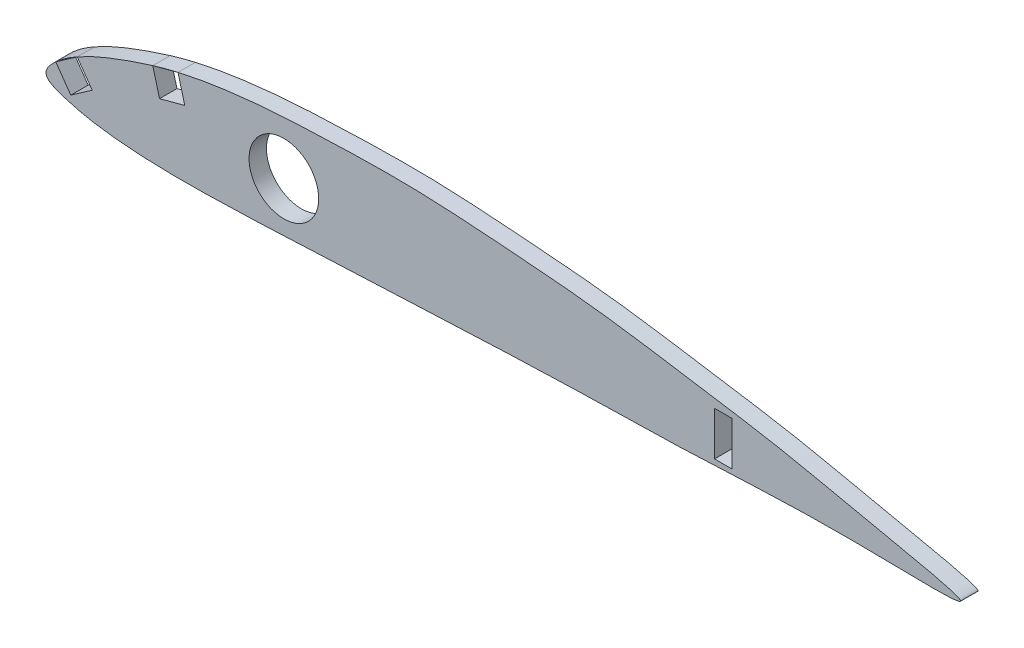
SolidWorks part; units mm, degrees
ref_plane "Front Plane" through (0, 0, 0) normal (0, 0, 1) x (1, 0, 0)
ref_plane "Top Plane" through (0, 0, 0) normal (0, 1, 0) x (1, 0, 0)
ref_plane "Right Plane" through (0, 0, 0) normal (1, 0, 0) x (0, 0, -1)
sketch3d "3DSketch1"
  spline S1 degree 3 poles (4.3194, -2.565, 0) (-1.596, -0.7014, 0) (1.9019, 2.8945, 0) (4.6685, 4.8759, 0) (8.2541, 6.8067, 0) (15.1207, 9.5999, 0) (23.4504, 12.2575, 0) (33.3103, 13.8343, 0) (41.6672, 14.6683, 0) (52.791, 15.1345, 0) (66.7098, 15.5292, 0) (83.3686, 14.3601, 0) (100.1477, 13.0526, 0) (116.546, 10.4257, 0) (134.137, 7.7365, 0) (147.5618, 4.5783, 0) (176.1388, -1.0823, 0) (139.163, 0.22, 0) (123.0831, -1.2515, 0) (88.371, -1.7987, 0) (61.2366, -3.2772, 0) (33.2994, -4.495, 0) (19.5697, -4.7201, 0) (9.464, -3.7414, 0) (4.3194, -2.565, 0) (-1.596, -0.7014, 0) (1.9019, 2.8945, 0) knots -0.051806 -0.027094 -0.014492 0 0.01056 0.018211 0.03221 0.045525 0.084069 0.108974 0.133649 0.158233 0.207343 0.256523 0.305826 0.355445 0.405214 0.45539 0.506007 0.555122 0.65337 0.70249 0.849939 0.899083 0.948194 0.972906 0.985508 1 1.01056 1.018211 1.03221 only from (0, 0, 0) to (0, 0, 0)
  dimension "D1" = 166.73
extrude "Boss-Extrude1" add sketch "3DSketch1" along direction (0, 0, 1) on the side of the normal blind 3.175
sketch "Sketch1" plane through (0, 0, 3.175) normal (0, 0, 1) x (1, 0, 0)
  line L0 (0, 0) -> (166.73, 0) construction
  line L1 (83.365, 0) -> (83.365, 5) construction
  line L2 (83.365, 5) -> (43.365, 5) construction
  line L3 (5.6876, 5.3863) -> (1.7864, 2.6546)
  line L4 (125.047, 0) -> (121.872, 0)
  line L5 (5.6876, 5.3863) -> (8.4193, 1.4851)
  line L6 (125.047, 0) -> (125.047, 8)
  line L7 (125.047, 8) -> (121.872, 8)
  line L8 (121.872, 0) -> (121.872, 8)
  line L9 (1.7864, 2.6546) -> (4.5181, -1.2466)
  line L10 (8.4193, 1.4851) -> (4.5181, -1.2466)
  line L11 (19.4658, 10.89) -> (24.066, 12.1227)
  line L12 (19.4658, 10.89) -> (20.6984, 6.2898)
  line L13 (24.066, 12.1227) -> (25.2986, 7.5224)
  line L14 (20.6984, 6.2898) -> (25.2986, 7.5224)
  circle A0 centre (43.365, 5) radius 6.35
  spline S0 degree 3 poles (1.9019, 2.8945) (-1.596, -0.7014) (4.3194, -2.565) (9.464, -3.7414) (19.5697, -4.7201) (33.2994, -4.495) (61.2366, -3.2772) (88.371, -1.7987) (123.0831, -1.2515) (139.163, 0.22) (176.1388, -1.0823) (147.5618, 4.5783) (134.137, 7.7365) (116.546, 10.4257) (100.1477, 13.0526) (83.3686, 14.3601) (66.7098, 15.5292) (52.791, 15.1345) (41.6672, 14.6683) (33.3103, 13.8343) (23.4504, 12.2575) (15.1207, 9.5999) (8.2541, 6.8067) (4.6685, 4.8759) (1.9019, 2.8945) (-1.596, -0.7014) (4.3194, -2.565) knots -0.03221 -0.018211 -0.01056 0 0.014492 0.027094 0.051806 0.100917 0.150061 0.29751 0.34663 0.444878 0.493993 0.54461 0.594786 0.644555 0.694174 0.743477 0.792657 0.841767 0.866351 0.891026 0.915931 0.954475 0.96779 0.981789 0.98944 1 1.014492 1.027094 1.051806 only from (0, 0) to (0, 0) construction
  spline S1 degree 3 poles (1.9019, 2.8945) (-1.596, -0.7014) (4.3194, -2.565) (9.464, -3.7414) (19.5697, -4.7201) (33.2994, -4.495) (61.2366, -3.2772) (88.371, -1.7987) (123.0831, -1.2515) (139.163, 0.22) (176.1388, -1.0823) (147.5618, 4.5783) (134.137, 7.7365) (116.546, 10.4257) (100.1477, 13.0526) (83.3686, 14.3601) (66.7098, 15.5292) (52.791, 15.1345) (41.6672, 14.6683) (33.3103, 13.8343) (23.4504, 12.2575) (15.1207, 9.5999) (8.2541, 6.8067) (4.6685, 4.8759) (1.9019, 2.8945) (-1.596, -0.7014) (4.3194, -2.565) knots -0.03221 -0.018211 -0.01056 0 0.014492 0.027094 0.051806 0.100917 0.150061 0.29751 0.34663 0.444878 0.493993 0.54461 0.594786 0.644555 0.694174 0.743477 0.792657 0.841767 0.866351 0.891026 0.915931 0.954475 0.96779 0.981789 0.98944 1 1.014492 1.027094 1.051806 only from (0, 0) to (0, 0) construction
  dimension "D3" = 41.682
  dimension "D1" = 5
  dimension "D2" = 40
  dimension "D4" = 8
  dimension "D5" = 3.175
  dimension "D6" = 4.7625
  dimension "D7" = 4.7625
  dimension "D8" = 55
  dimension "D9" = 4.7625
  dimension "D10" = 4.7625
  dimension "D11" = 75
extrude "Cut-Extrude2" cut sketch "Sketch1" against normal blind 10
